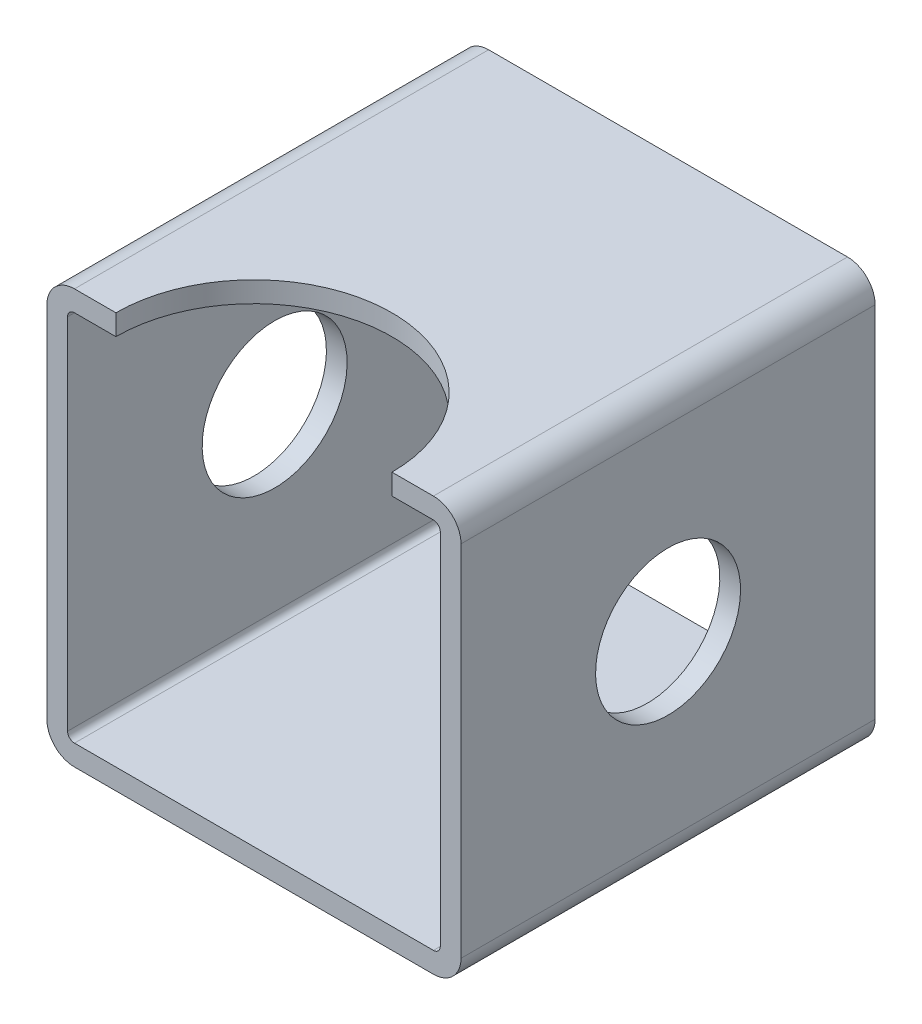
SolidWorks part; units mm, degrees
ref_plane "Face" through (0, 0, 0) normal (0, 0, 1) x (1, 0, 0)
ref_plane "Dessus" through (0, 0, 0) normal (0, 1, 0) x (1, 0, 0)
ref_plane "Droite" through (0, 0, 0) normal (1, 0, 0) x (0, 0, -1)
sketch "Esquisse1" plane through (0, 0, 0) normal (0, 0, 1) x (1, 0, 0)
  line L0 (4, -3) -> (56, -3)
  line L1 (4, 0) -> (56, 0)
  line L2 (0, -4) -> (0, -56)
  line L3 (4, -60) -> (56, -60)
  line L4 (60, -4) -> (60, -56)
  line L5 (57, -4) -> (57, -56)
  line L6 (4, -57) -> (56, -57)
  line L7 (3, -4) -> (3, -56)
  arc A0 (56, -60) -> (60, -56) centre (56, -56) ccw
  arc A1 (4, -60) -> (0, -56) centre (4, -56) cw
  arc A2 (4, 0) -> (0, -4) centre (4, -4) ccw
  arc A3 (56, 0) -> (60, -4) centre (56, -4) cw
  arc A4 (56, -3) -> (57, -4) centre (56, -4) cw
  arc A5 (56, -57) -> (57, -56) centre (56, -56) ccw
  arc A6 (4, -57) -> (3, -56) centre (4, -56) cw
  arc A7 (4, -3) -> (3, -4) centre (4, -4) ccw
  point P9 (0, -60)
  point P12 (0, 0)
  point P15 (60, 0)
  dimension "D3" = 4
  dimension "D1" = 60
  dimension "D2" = 60
  dimension "D4" = 3
extrude "Base-Extrusion" add sketch "Esquisse1" along normal blind 60
sketch "Esquisse2" plane through (0, 0, 0) normal (0, 1, 0) x (-1, 0, 0)
  line L0 (-56, 60) -> (-4, 60) construction
  circle A0 centre (-30, 60) radius 20
  dimension "D1" = 40
extrude "Enlèv. mat.-Extru.1" cut sketch "Esquisse2" against normal blind 5
sketch "Esquisse3" plane through (60, 0, 0) normal (1, 0, 0) x (0, 0, -1)
  line L0 (-60, 0) -> (0, 0) construction
  line L1 (-60, -56) -> (-60, -4) construction
  circle A0 centre (-30, -30) radius 10.5
  dimension "D1" = 21
  dimension "D2" = 30
  dimension "D3" = 30
extrude "Enlèv. mat.-Extru.2" cut sketch "Esquisse3" against normal through all
